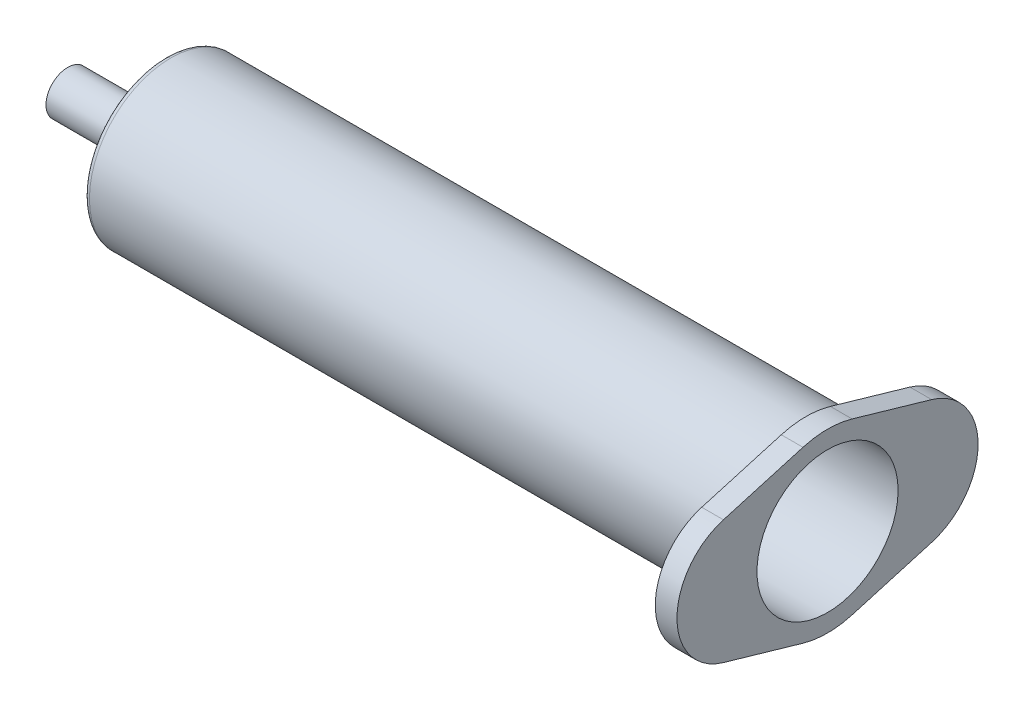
SolidWorks part; units mm, degrees
ref_plane "Front Plane" through (0, 0, 0) normal (0, 0, 1) x (1, 0, 0)
ref_plane "Top Plane" through (0, 0, 0) normal (0, 1, 0) x (1, 0, 0)
ref_plane "Right Plane" through (0, 0, 0) normal (1, 0, 0) x (0, 0, -1)
sketch "Sketch1" plane through (0, 0, 0) normal (1, 0, 0) x (0, 0, -1)
  circle A0 centre (0, 0) radius 7.5
  dimension "D1" = 15
extrude "Boss-Extrude1" add sketch "Sketch1" along normal blind 61
sketch "Sketch2" plane through (61, 0, 0) normal (1, 0, 0) x (0, 0, -1)
  circle A0 centre (0, 0) radius 6.5
  dimension "D1" = 13
extrude "Cut-Extrude1" cut sketch "Sketch2" against normal blind 59
sketch "Sketch3" plane through (0, 0, 0) normal (-1, 0, 0) x (0, 0, 1)
  circle A0 centre (0, 0) radius 2
  dimension "D1" = 4
extrude "Boss-Extrude2" add sketch "Sketch3" along normal blind 9
sketch "Sketch4" plane through (-9, 0, 0) normal (-1, 0, 0) x (0, 0, 1)
  circle A0 centre (0, 0) radius 1.5
  dimension "D1" = 3
extrude "Cut-Extrude2" cut sketch "Sketch4" against normal through all
chamfer "Chamfer1" distance 1.5 angle 52 1 edges at (2, 0, -1.5)
fillet "Fillet2" radius 2 1 edges at (2, 0, -3)
fillet "Fillet3" radius 0.5 1 edges at (0, 0, 2)
fillet "Fillet4" radius 0.5 1 edges at (0, 0, -7.5)
sketch "Sketch5" plane through (61, 0, 0) normal (1, 0, 0) x (0, 0, -1)
  line L0 (0, 10.4899) -> (0, -11.8634) construction
  line L1 (-2.2617, 7.8168) -> (-9.5899, 5.6964)
  line L2 (-9.5899, 0) -> (10.3941, 0) construction
  line L3 (-2.2617, -7.8168) -> (-9.5899, -5.6964)
  line L4 (2.2617, -7.8168) -> (9.5899, -5.6964)
  line L5 (2.2617, 7.8168) -> (9.5899, 5.6964)
  arc A0 (-2.2617, -7.8168) -> (2.2617, -7.8168) centre (0, 0) ccw
  arc A1 (-9.5899, 5.6964) -> (-9.5899, -5.6964) centre (-7.9417, 0) ccw
  arc A2 (9.5899, 5.6964) -> (9.5899, -5.6964) centre (7.9417, 0) cw
  arc A3 (2.2617, 7.8168) -> (-2.2617, 7.8168) centre (0, 0) ccw
extrude "Boss-Extrude3" add sketch "Sketch5" against normal blind 2
sketch "Sketch6" plane through (61, 0, 0) normal (1, 0, 0) x (0, 0, -1)
  circle A0 centre (0, 0) radius 6.5
  dimension "D1" = 13
extrude "Cut-Extrude7" cut sketch "Sketch6" against normal blind 2
sketch "Sketch7" plane through (59, 0, 0) normal (-1, 0, 0) x (0, 0, 1)
  line L0 (0, 8.8181) -> (0, -10.5789) construction
  line L1 (-17.125, 0) -> (18.6302, 0) construction
  line L2 (-12.225, -1.5) -> (-12.225, 1.5) construction
  line L3 (-12.6, -1.5) -> (-12.6, 1.5)
  line L4 (-11.85, -1.5) -> (-11.85, 1.5)
  line L5 (-10.475, -3) -> (-10.475, 3) construction
  line L6 (-10.85, -3) -> (-10.85, 3)
  line L7 (-10.1, -3) -> (-10.1, 3)
  line L8 (-8.725, -4.5) -> (-8.725, 4.5) construction
  line L9 (-9.1, -4.5) -> (-9.1, 4.5)
  line L10 (-8.35, -4.5) -> (-8.35, 4.5)
  line L11 (12.225, -1.5) -> (12.225, 1.5) construction
  line L12 (12.6, -1.5) -> (12.6, 1.5)
  line L13 (11.85, -1.5) -> (11.85, 1.5)
  line L14 (10.475, -3) -> (10.475, 3) construction
  line L15 (10.85, -3) -> (10.85, 3)
  line L16 (10.1, -3) -> (10.1, 3)
  line L17 (8.725, -4.5) -> (8.725, 4.5) construction
  line L18 (9.1, -4.5) -> (9.1, 4.5)
  line L19 (8.35, -4.5) -> (8.35, 4.5)
  arc A0 (-12.6, -1.5) -> (-11.85, -1.5) centre (-12.225, -1.5) ccw
  arc A1 (-11.85, 1.5) -> (-12.6, 1.5) centre (-12.225, 1.5) ccw
  arc A2 (-10.85, -3) -> (-10.1, -3) centre (-10.475, -3) ccw
  arc A3 (-10.1, 3) -> (-10.85, 3) centre (-10.475, 3) ccw
  arc A4 (-9.1, -4.5) -> (-8.35, -4.5) centre (-8.725, -4.5) ccw
  arc A5 (-8.35, 4.5) -> (-9.1, 4.5) centre (-8.725, 4.5) ccw
  circle A6 centre (0, 0) radius 7.5 construction
  arc A7 (12.6, -1.5) -> (11.85, -1.5) centre (12.225, -1.5) cw
  arc A8 (11.85, 1.5) -> (12.6, 1.5) centre (12.225, 1.5) cw
  arc A9 (10.85, -3) -> (10.1, -3) centre (10.475, -3) cw
  arc A10 (10.1, 3) -> (10.85, 3) centre (10.475, 3) cw
  arc A11 (9.1, -4.5) -> (8.35, -4.5) centre (8.725, -4.5) cw
  arc A12 (8.35, 4.5) -> (9.1, 4.5) centre (8.725, 4.5) cw
  point P7 (-12.225, 0)
  point P14 (-10.475, 0)
  point P21 (-8.725, 0)
  point P33 (12.225, 0)
  point P40 (10.475, 0)
  point P47 (8.725, 0)
  dimension "D1" = 9
  dimension "D2" = 6
  dimension "D3" = 1
  dimension "D4" = 0.75
  dimension "D5" = 0.75
  dimension "D6" = 0.75
  dimension "D7" = 1
  dimension "D8" = 8.35
  dimension "D9" = 3
extrude "Boss-Extrude4" add sketch "Sketch7" along normal blind 0.5
fillet "Fillet7" radius 0.375 24 edges at (58.5, 0, 8.35) (58.5, 4.875, 8.725) (58.5, 0, 9.1) (58.5, -4.875, 8.725) (58.5, 0, 11.85) (58.5, 1.875, 12.225) (58.5, 0, 12.6) (58.5, -1.875, 12.225) (58.5, 0, 10.1) (58.5, 3.375, 10.475) (58.5, 0, 10.85) (58.5, -3.375, 10.475) (58.5, 0, -12.6) (58.5, 1.875, -12.225) (58.5, 0, -11.85) (58.5, -1.875, -12.225) (58.5, 0, -10.85) (58.5, 3.375, -10.475) (58.5, 0, -10.1) (58.5, -3.375, -10.475) (58.5, 0, -9.1) (58.5, 4.875, -8.725) (58.5, 0, -8.35) (58.5, -4.875, -8.725)
